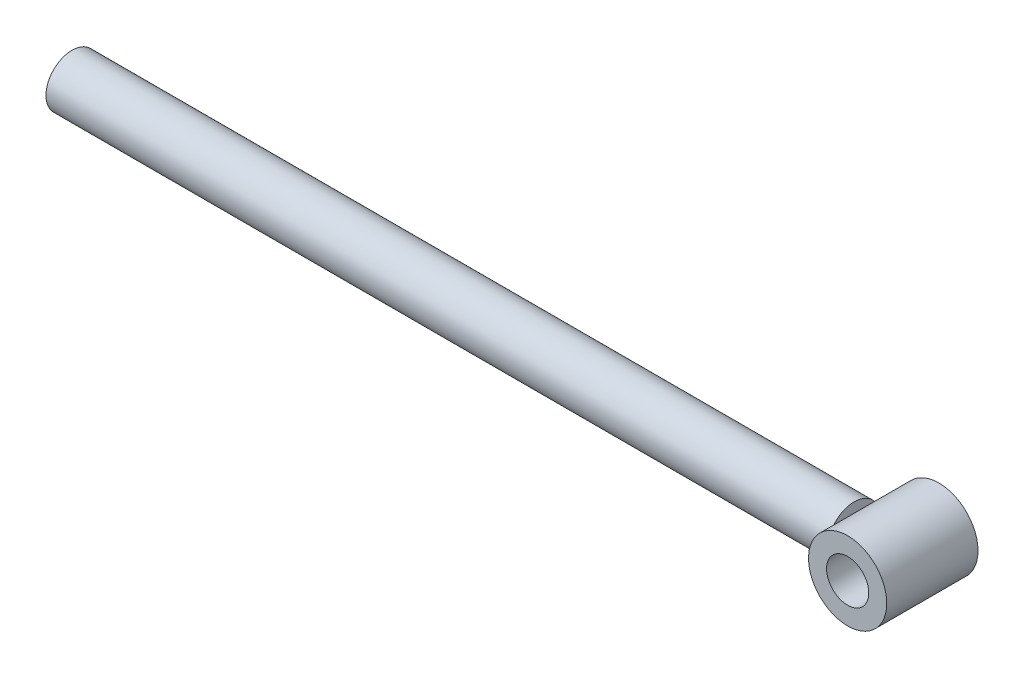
SolidWorks part; units mm, degrees
ref_plane "Plan de face" through (0, 0, 0) normal (0, 0, 1) x (1, 0, 0)
ref_plane "Plan de dessus" through (0, 0, 0) normal (0, 1, 0) x (1, 0, 0)
ref_plane "Plan de droite" through (0, 0, 0) normal (1, 0, 0) x (0, 0, -1)
sketch "Esquisse1" plane through (0, 0, 0) normal (1, 0, 0) x (0, 0, -1)
  circle A0 centre (0, 0) radius 10
  dimension "D1" = 20
extrude "Extrusion1" add sketch "Esquisse1" along normal blind 300
sketch "Esquisse2" plane through (0, 0, 0) normal (0, 0, 1) x (1, 0, 0)
  line L0 (300, -10) -> (300, 10) construction
  circle A0 centre (315, 0) radius 15
  circle A1 centre (315, 0) radius 8.1
  dimension "D1" = 16.2
  dimension "D2" = 30
extrude "Extrusion2" add sketch "Esquisse2" along normal mid plane 35
ref_plane "Plan1" through (287, 0, 0) normal (1, 0, 0) x (0, 0, -1)
